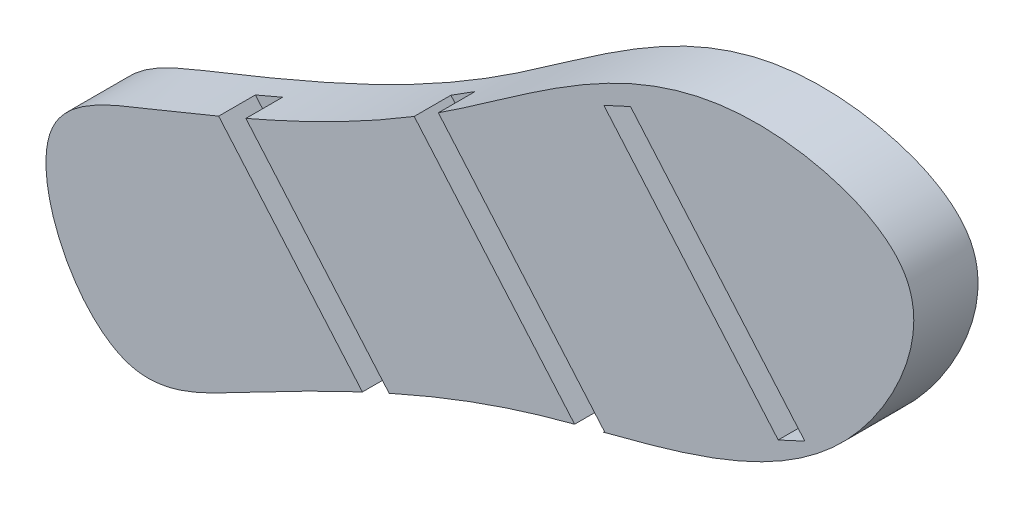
SolidWorks part; units mm, degrees
ref_plane "Alzado" through (0, 0, 0) normal (0, 0, 1) x (1, 0, 0)
ref_plane "Planta" through (0, 0, 0) normal (0, 1, 0) x (1, 0, 0)
ref_plane "Vista lateral" through (0, 0, 0) normal (1, 0, 0) x (0, 0, -1)
ref_plane "Plano_goma" through (0, 0, 12.5) normal (0, 0, 1) x (1, 0, 0)
sketch "Sk_Goma" plane through (0, 0, 0) normal (0, 0, 1) x (1, 0, 0)
  spline S0 degree 3 poles (434.3863, 332.3422) (428.9443, 344.1331) (441.1466, 348.8882) (453.6205, 354.2888) (465.9627, 365.6031) (480.5578, 360.8034) (474.7412, 346.583) (458.1239, 344.5314) (445.9213, 338.5429) (434.3863, 332.3422) (428.9443, 344.1331) (441.1466, 348.8882) knots -0.299528 -0.141321 -0.087871 0 0.05345 0.211657 0.387435 0.456064 0.524694 0.700472 0.858679 0.912129 1 1.05345 1.211657 1.387435 only from (431.735, 343.7767) to (431.735, 343.7767)
extrude "Goma" add sketch "Sk_Goma" along normal blind 3.5 from offset 12.5
sketch "Sk_Ranuras_agua" plane through (0, 0, 12.5) normal (0, 0, 1) x (1, 0, 0)
  line L0 (439.9765, 349.7832) -> (441.4292, 350.4537)
  line L1 (441.4292, 350.4537) -> (450.9278, 339.4185)
  line L2 (450.9278, 339.4185) -> (449.4751, 338.748)
  line L3 (449.4751, 338.748) -> (439.9765, 349.7832)
  line L4 (450.872, 354.8119) -> (452.3247, 355.4824)
  line L5 (452.3247, 355.4824) -> (461.8234, 344.4472)
  line L6 (461.8234, 344.4472) -> (460.3706, 343.7767)
  line L7 (460.3706, 343.7767) -> (450.872, 354.8119)
  line L8 (461.7675, 359.8406) -> (463.2202, 360.5111)
  line L9 (463.2202, 360.5111) -> (472.7189, 349.4759)
  line L10 (472.7189, 349.4759) -> (471.2661, 348.8054)
  line L11 (471.2661, 348.8054) -> (461.7675, 359.8406)
extrude "Ranuras_agua" cut sketch "Sk_Ranuras_agua" along normal blind 2
mirror "Simetria_lado_izq" about plane through (0, 0, 0) normal (0, 0, 1)
delete or keep bodies "Borrar_original_dcho" type delete bodies bodies 102
